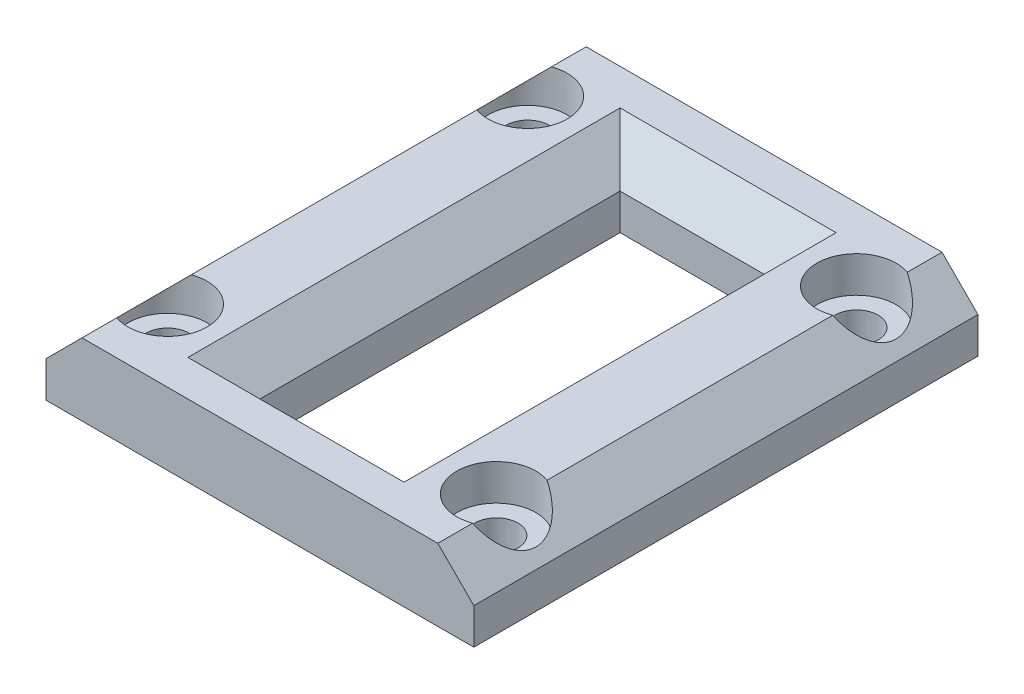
SolidWorks part; units mm, degrees
ref_plane "Front Plane" through (0, 0, 0) normal (0, 0, 1) x (1, 0, 0)
ref_plane "Top Plane" through (0, 0, 0) normal (0, 1, 0) x (1, 0, 0)
ref_plane "Right Plane" through (0, 0, 0) normal (1, 0, 0) x (0, 0, -1)
sketch "Sketch1" plane through (0, 0, 0) normal (0, 1, 0) x (1, 0, 0)
  line L1 (0, 0) -> (23.76, 0)
  line L2 (0, 0) -> (0, -28)
  line L3 (0, -28) -> (23.76, -28)
  line L4 (23.76, 0) -> (23.76, -28)
  dimension "D1" = 28
  dimension "D2" = 23.76
extrude "Boss-Extrude1" add sketch "Sketch1" along normal blind 4
sketch "Sketch2" plane through (0, 4, 0) normal (0, 1, 0) x (1, 0, 0)
  line L0 (0, 0) -> (0, -28) construction
  line L1 (23.76, 0) -> (0, 0) construction
  line L2 (23.76, -28) -> (23.76, 0) construction
  line L3 (0, -28) -> (23.76, -28) construction
  point P0 (2.75, -4)
  point P1 (21.01, -4)
  point P2 (21.01, -24)
  point P3 (2.75, -24)
  dimension "D1" = 2.75
  dimension "D2" = 4
  dimension "D3" = 4
  dimension "D4" = 2.75
  dimension "D5" = 2.75
  dimension "D6" = 2.75
  dimension "D7" = 4
  dimension "D8" = 4
hole_wizard "CBORE for M2 SHCS1" positions "Sketch3" profile "Sketch4" counterbore size "M2" standard "ANSI Metric"
sketch "Sketch3" plane through (0, 4, 0) normal (0, 1, 0) x (1, 0, 0)
  point P0 (2.75, -4)
  point P3 (2.75, -24)
  point P6 (21.01, -24)
  point P9 (21.01, -4)
sketch "Sketch4" plane through (2.75, 4, 4) normal (1, 0, 0) x (0, 0, 1)
  line L0 (0, 0) -> (0, 4)
  line L1 (0, 4) -> (1.2, 4)
  line L3 (1.2, 4) -> (1.2, 2)
  line L4 (1.2, 2) -> (2.2, 2)
  line L5 (2.2, 2) -> (2.2, 0)
  line L7 (2.2, 0) -> (0, 0)
  line L11 (0, -6.35) -> (0, 107.95) construction
  dimension "Thru Hole Dia." = 2.4
  dimension "Thru Hole Depth" = 4
  dimension "C'Bore Dia." = 4.4
  dimension "C'Bore Depth" = 2
sketch "Sketch5" plane through (0, 4, 0) normal (0, 1, 0) x (1, 0, 0)
  line L0 (23.76, 0) -> (0, 0) construction
  line L1 (7.8828, -4) -> (15.8828, -4)
  line L2 (7.8828, -4) -> (7.8828, -24)
  line L3 (7.8828, -24) -> (15.8828, -24)
  line L4 (15.8828, -4) -> (15.8828, -24)
  dimension "D1" = 20
  dimension "D2" = 4
  dimension "D3" = 8
extrude "Cut-Extrude1" cut sketch "Sketch5" against normal blind 4
chamfer "Chamfer2" distance 2 angle 45 2 edges at (11.8828, 4, 24) (11.8828, 4, 4)
chamfer "Chamfer3" distance 2 angle 45 2 edges at (15.8828, 4, 14) (7.8828, 4, 14)
chamfer "Chamfer4" distance 2 angle 45 2 edges at (0, 4, 14) (23.76, 4, 14)
